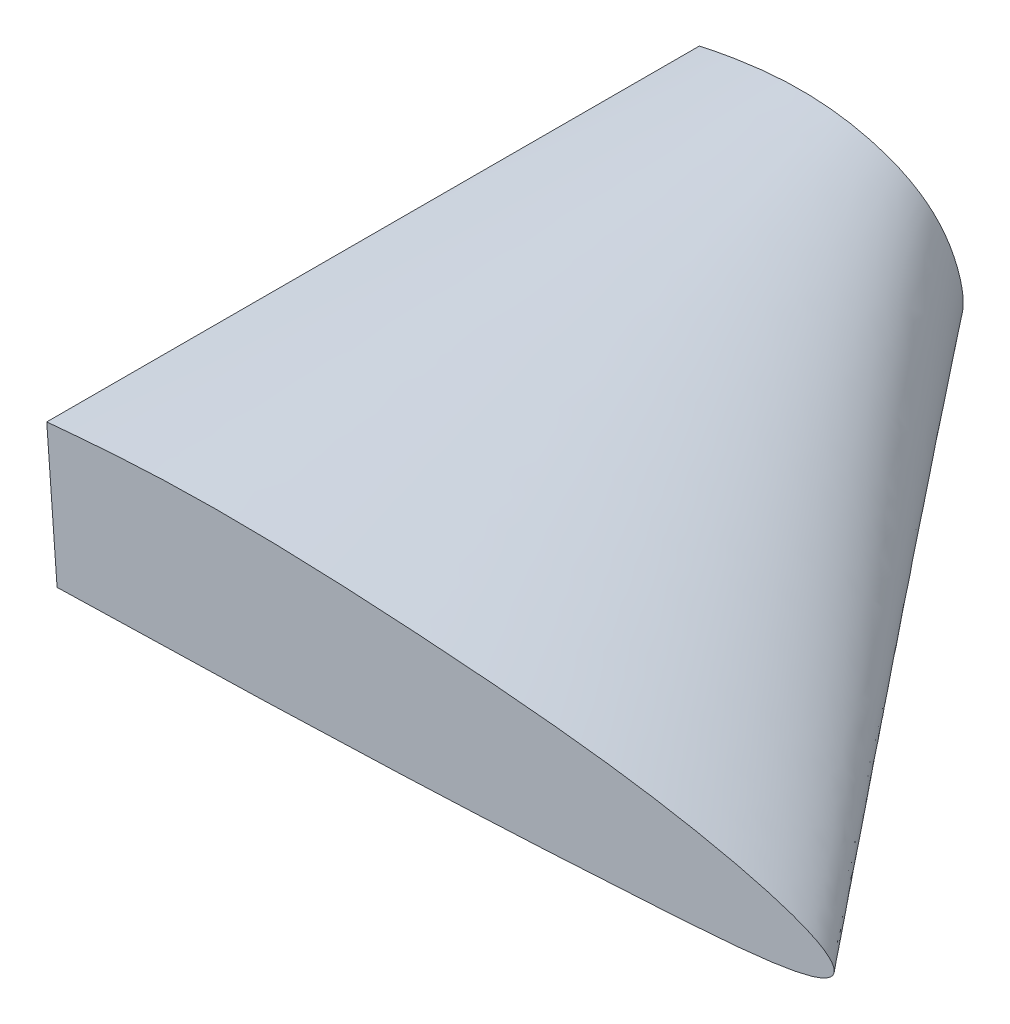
SolidWorks part; units mm, degrees
ref_plane "XY" through (0, 0, 0) normal (0, 0, 1) x (1, 0, 0)
ref_plane "XZ" through (0, 0, 0) normal (0, 1, 0) x (1, 0, 0)
ref_plane "YZ" through (0, 0, 0) normal (1, 0, 0) x (0, 0, -1)
ref_plane "Plane1" through (0, 0, 1168.4) normal (0, 0, 1) x (1, 0, 0)
sketch "Sketch1" plane through (0, 0, 0) normal (0, 0, 1) x (1, 0, 0)
  line L2 (972.7091, 246.0637) -> (991.0795, 0)
  line L3 (991.0795, 0) -> (1134.3919, 0)
  line L4 (972.7091, 246.0637) -> (991.0795, 0)
  line L5 (991.0795, 0) -> (1134.3919, 0)
  spline S1 degree 3 poles (1134.3919, 0) (1288.0646, -5.8036) (1484.6683, -13.2286) (1416.3074, 198.0825) (1235.6937, 286.2877) (1078.365, 268.9367) (972.7091, 246.0637) knots 0 0 0 0 0.319585 0.408866 0.565476 0.879497 0.879497 0.879497 0.879497
  spline S2 degree 3 poles (1134.3919, 0) (1288.0646, -5.8036) (1484.6683, -13.2286) (1416.3074, 198.0825) (1235.6937, 286.2877) (1078.365, 268.9367) (972.7091, 246.0637) knots 0 0 0 0 0.319585 0.408866 0.565476 0.879497 0.879497 0.879497 0.879497
  dimension "D1" = 0
sketch "Sketch2" plane through (0, 0, 1168.4) normal (0, 0, 1) x (1, 0, 0)
  line L0 (991.0795, 0) -> (972.6118, 247.3665)
  spline S0 degree 3 poles (991.0795, 0) (1318.1524, 7.7639) (1732.5668, 17.601) (2432.7287, 66.0722) (2378.3319, 146.1583) (2010.3301, 220.7737) (1331.7874, 279.1953) (1133.1052, 261.5888) (972.6118, 247.3665) knots 0 0 0 0 0.389153 0.493072 0.615837 0.672676 0.735591 1 1 1 1
  dimension "D1" = 1072.2701
  dimension "D2" = 1356.9198
  dimension "D3" = 729.0918
  dimension "D4" = 41.338
  dimension "D5" = 74.296
  dimension "D6" = 246.0637
loft "Base-Loft" add profiles "Sketch1", "Sketch2"
